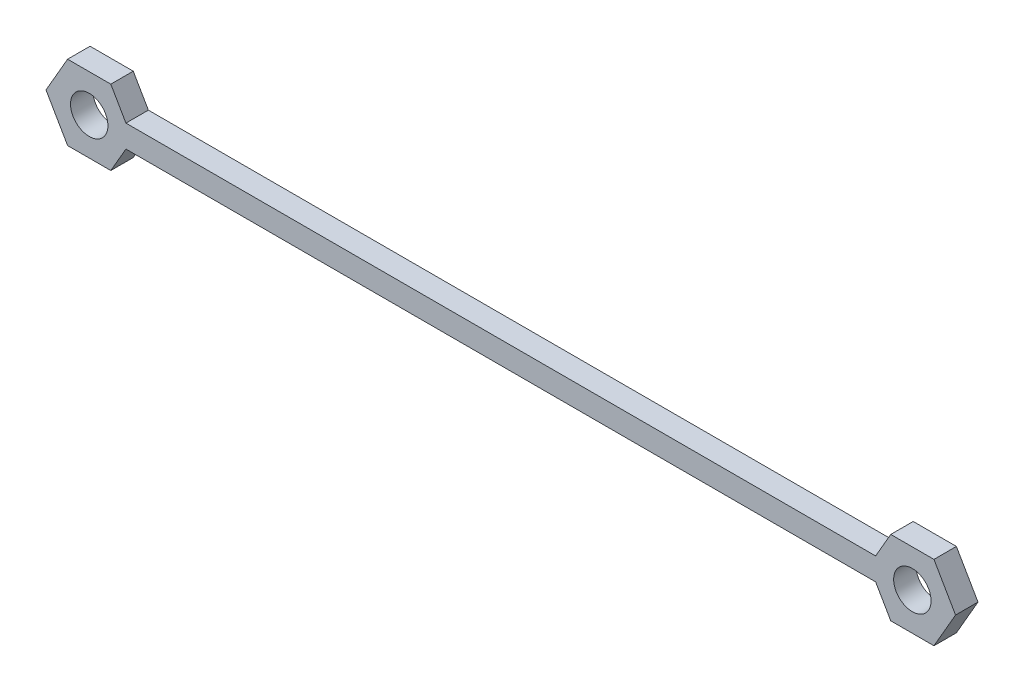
SolidWorks part; units mm, degrees
ref_plane "Alzado" through (0, 0, 0) normal (0, 0, 1) x (1, 0, 0)
ref_plane "Planta" through (0, 0, 0) normal (0, 1, 0) x (1, 0, 0)
ref_plane "Vista lateral" through (0, 0, 0) normal (1, 0, 0) x (0, 0, -1)
sketch "Croquis1" plane through (0, 0, 0) normal (0, 0, 1) x (1, 0, 0)
  line L0 (0, 0) -> (0, 118497.7771) construction
  line L1 (-55, 0) -> (55, 0) construction
  line L2 (52.1132, -5) -> (49.2265, 0) construction
  line L3 (-49.2265, 0) -> (-52.1132, 5) construction
  line L4 (-52.1132, 5) -> (-57.8868, 5)
  line L5 (-57.8868, 5) -> (-60.7735, 0)
  line L6 (-60.7735, 0) -> (-57.8868, -5)
  line L7 (-57.8868, -5) -> (-52.1132, -5)
  line L8 (-52.1132, -5) -> (-49.2265, 0) construction
  line L9 (49.2265, 0) -> (52.1132, 5) construction
  line L10 (57.8868, -5) -> (52.1132, -5)
  line L11 (60.7735, 0) -> (57.8868, -5)
  line L12 (57.8868, 5) -> (60.7735, 0)
  line L13 (52.1132, 5) -> (57.8868, 5)
  line L14 (-50.0925, 1.5) -> (50.0925, 1.5)
  line L15 (52.1132, 5) -> (50.0925, 1.5)
  line L16 (-52.1132, 5) -> (-50.0925, 1.5)
  line L17 (-50.0925, -1.5) -> (50.0925, -1.5)
  line L18 (-50.0925, -1.5) -> (-52.1132, -5)
  line L19 (50.0925, -1.5) -> (52.1132, -5)
  circle A0 centre (-55, 0) radius 2.5
  circle A1 centre (55, 0) radius 2.5
  circle A2 centre (-55, 0) radius 5 construction
  circle A3 centre (55, 0) radius 5 construction
  point P5 (0, 0)
  dimension "D2" = 5
  dimension "D4" = 10
  dimension "D1" = 110
  dimension "D3" = 1.5
extrude "Saliente-Extruir1" add sketch "Croquis1" along normal mid plane 3
